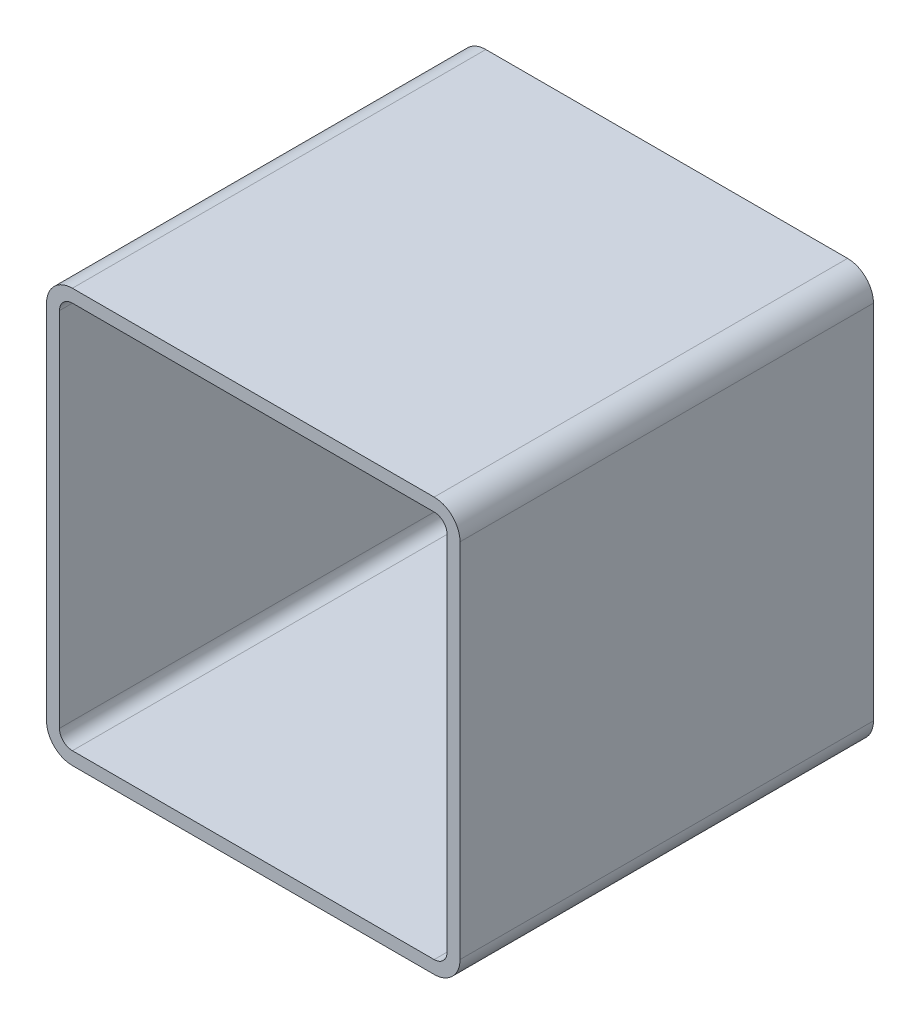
SolidWorks part; units mm, degrees
ref_plane "Front Plane" through (0, 0, 0) normal (0, 0, 1) x (1, 0, 0)
ref_plane "Top Plane" through (0, 0, 0) normal (0, 1, 0) x (1, 0, 0)
ref_plane "Right Plane" through (0, 0, 0) normal (1, 0, 0) x (0, 0, -1)
sketch "Sketch1" plane through (0, 0, 0) normal (0, 0, 1) x (1, 0, 0)
sketch_block_instance "HSS12x12x0.375-1"
sketch_block "HSS12x12x0.375"
extrude "Boss-Extrude1" add sketch "Sketch1" along normal blind 304.8
